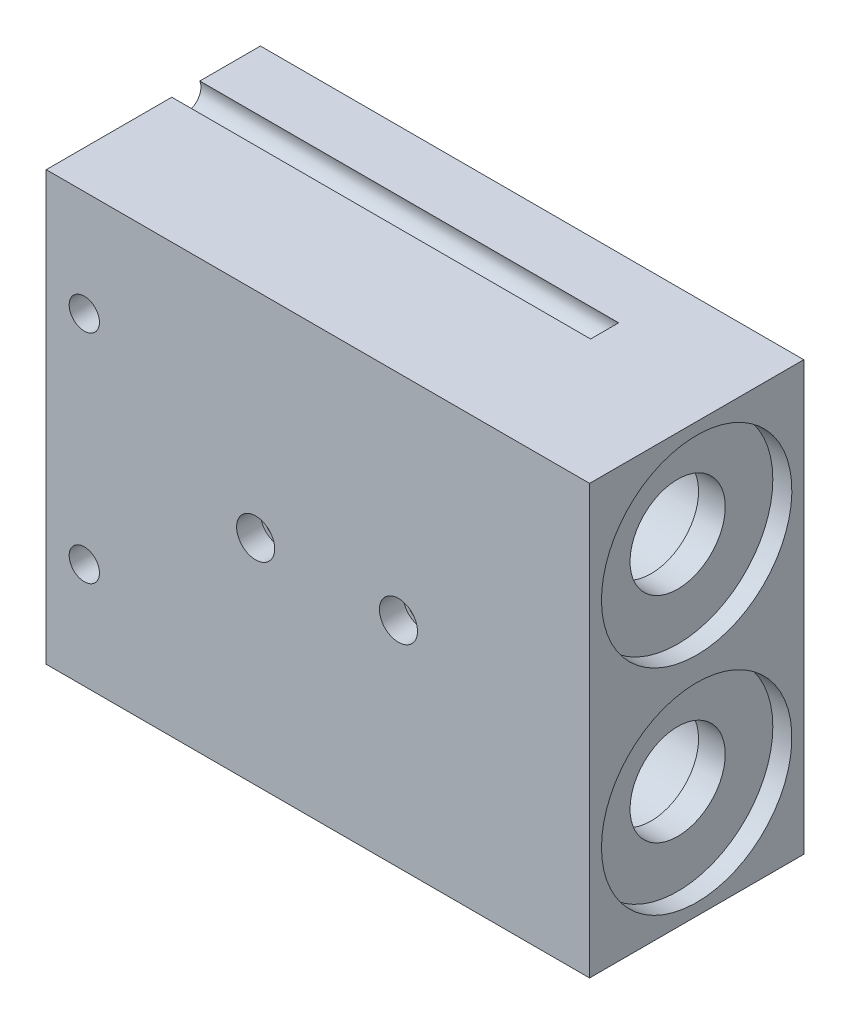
SolidWorks part; units mm, degrees
ref_plane "Front" through (0, 0, 0) normal (0, 0, 1) x (1, 0, 0)
ref_plane "Top" through (0, 0, 0) normal (0, 1, 0) x (1, 0, 0)
ref_plane "Right" through (0, 0, 0) normal (1, 0, 0) x (0, 0, -1)
imported_body "Imported1"
sketch "Sketch1" plane through (34.9758, 0, 0) normal (1, 0, 0) x (0, 0, -1)
  circle A0 centre (0, -14.2875) radius 12.7
  circle A1 centre (0, 14.2875) radius 12.7
  circle A2 centre (0, 14.2875) radius 12.7 construction
  circle A3 centre (0, -14.2875) radius 12.7 construction
extrude "Cut-Extrude1" cut sketch "Sketch1" against normal blind 1.27
